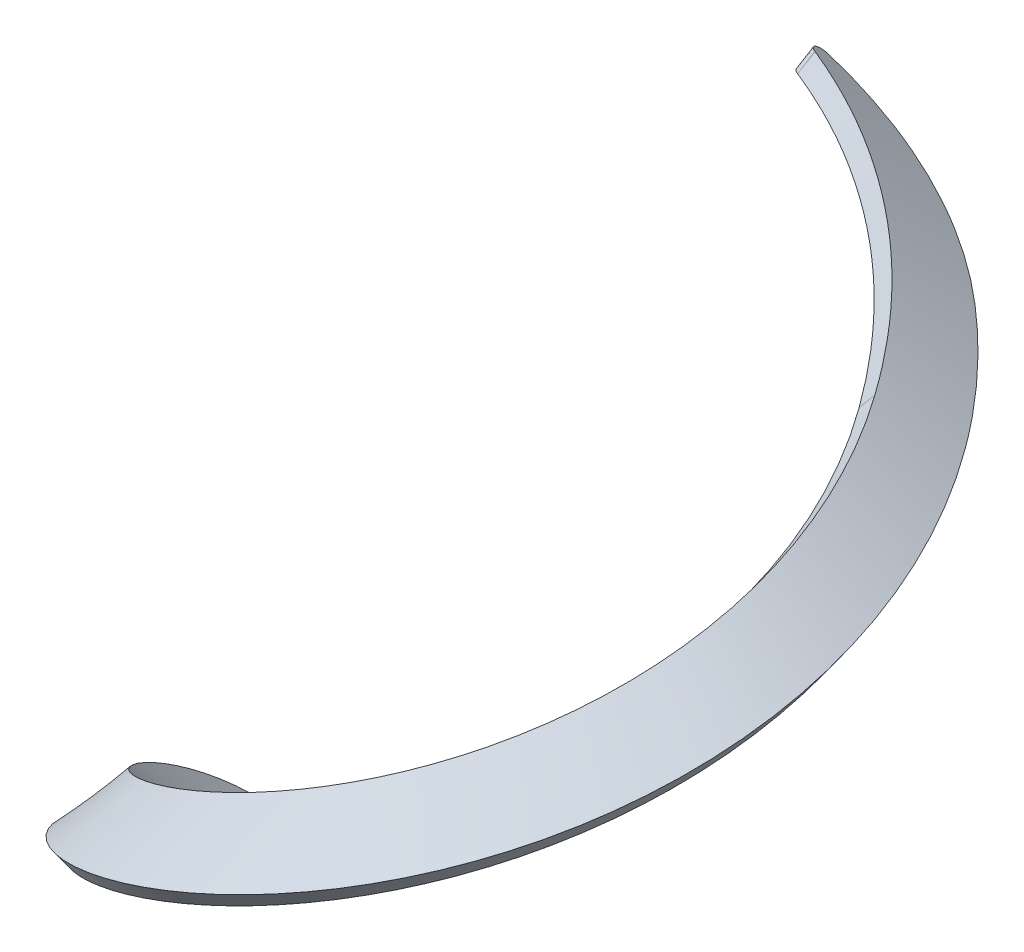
SolidWorks part; units mm, degrees
ref_plane "Vorne" through (0, 0, 0) normal (0, 0, 1) x (1, 0, 0)
ref_plane "Oben" through (0, 0, 0) normal (0, 1, 0) x (1, 0, 0)
ref_plane "Rechts" through (0, 0, 0) normal (1, 0, 0) x (0, 0, -1)
sketch "Skizze1" plane through (0, 0, 0) normal (0, 1, 0) x (1, 0, 0)
  circle A0 centre (0, 0) radius 75
  dimension "D1" = 150
curve "Spirale/Helix1"
sketch "Skizze2" plane through (0, 0, 0) normal (0, 0, 1) x (1, 0, 0)
  line L0 (-75, 0) -> (-38.1382, 25.8109)
  line L1 (0, 0) -> (0, 43.8467) construction
  line L2 (-75, 0) -> (-81.8829, 9.8298)
  dimension "D1" = 35
  dimension "D2" = 45
  dimension "D3" = 12
ref_plane "Ebene1" through (-75, 0, 0) normal (-0.4059, 0.5797, 0.7065) x (0.9127, 0.2178, 0.3457)
ref_plane "Ebene2" through (0, 25.8109, 0) normal (0, 1, 0) x (-1, 0, 0)
sketch "Skizze4" plane through (0, 25.8109, 0) normal (0, 1, 0) x (-1, 0, 0)
  circle A0 centre (0, 0) radius 38.1382
curve "Spirale/Helix2"
sketch3d "3D-Skizze1"
  spline S1 degree 3 number of poles 66 (-75, 0, 0) -> (0, 290, -278.0602)
  spline S2 degree 3 number of poles 66 (-75, 0, 0) -> (0, 290, -278.0602)
  dimension "D1" = 0
sketch3d "3D-Skizze2"
  spline S1 degree 3 number of poles 66 (-38.1382, 25.8109, 0) -> (0, 315.8109, -241.1983)
  spline S2 degree 3 number of poles 66 (-38.1382, 25.8109, 0) -> (0, 315.8109, -241.1983)
  dimension "D1" = 0
sheet metal parameters "Blech1" thickness 12 parameters "D1"=2, "Dicke"=12
lofted bend "Ausgeformte Biegungen1" parameters "D1"=0, "D12"=12
other "Freiform-Biegung1" parameters "D1"=1000, "D4"=57.296, "D5"=1
unfold "Entfalten1"
sketch "Skizze5" plane through (109.3476, 309.5529, -216.7513) normal (0.278, 0.7869, -0.551) x (0.9606, -0.2277, 0.1594)
  line L0 (-110.361, 16.4364) -> (-110.361, 61.4364) construction
  line L1 (67.1321, -39.7615) -> (40.7459, -76.2138) construction
  line L2 (40.7459, -76.2138) -> (-150.361, -15.95) construction
  line L3 (-150.361, -15.95) -> (-150.361, 106.4364)
  line L4 (-150.361, 106.4364) -> (28.3624, 106.4364)
  line L5 (28.3624, 106.4364) -> (28.3624, 33.4672)
  line L6 (-105.361, 36.4364) -> (-150.361, 36.4364) construction
  line L7 (-110.361, 61.4364) -> (-110.361, 106.4364) construction
  line L8 (-110.361, 16.4364) -> (-110.361, -28.5636) construction
  arc A0 (-106.7805, 41.2307) -> (-106.1271, 31.4954) centre (-105.361, 36.4364) ccw construction
  arc A1 (-106.7805, 41.2307) -> (28.3624, 33.4672) centre (-50.0026, -150.5407) cw
  arc A2 (-106.1271, 31.4954) -> (67.1321, -39.7615) centre (-167.4117, -363.7819) cw construction
  arc A3 (-106.7805, 41.2307) -> (-150.361, -15.95) centre (-89.4991, -17.1383) ccw
  spline S0 degree 3 number of poles 94 (-110.361, 61.4364) -> (-45.7331, -483.7139) construction
  spline S2 degree 3 number of poles 84 (-36.7212, -439.6255) -> (-110.361, 16.4364) construction
  dimension "D1" = 20
  dimension "D2" = 5
  dimension "D3" = 200
  dimension "D4" = 400
extrude "Schnitt-Linear austragen1" cut sketch "Skizze5" against normal up to next
sketch "Skizze6" plane through (109.3476, 309.5529, -216.7513) normal (0.278, 0.7869, -0.551) x (0.9606, -0.2277, 0.1594)
  line L0 (67.1321, -39.7615) -> (40.7459, -76.2138) construction
  line L1 (67.1321, -39.7615) -> (40.7459, -76.2138)
  line L2 (40.7459, -76.2138) -> (-150.361, -15.95) construction
  line L3 (40.7459, -76.2138) -> (-150.361, -15.95)
  line L4 (-106.1271, 31.4954) -> (-150.361, -15.95) construction
  line L6 (-150.361, 36.4364) -> (-150.361, -15.95)
  arc A0 (67.1321, -39.7615) -> (-106.1271, 31.4954) centre (-167.4117, -363.7819) ccw construction
  arc A1 (67.1321, -39.7615) -> (-106.1271, 31.4954) centre (-167.4117, -363.7819) ccw
  arc A3 (-106.1271, 31.4954) -> (-150.361, 36.4364) centre (-186.2319, -485.1697) ccw
extrude "Schnitt-Linear austragen2" cut sketch "Skizze6" against normal through all
fold "Falten12"
fillet "Verrundung1" radius 5 6 edges
flat pattern "Abwicklung1"
sketch "Biegung-Linien1" plane through (-8.928, 12.7504, -20.6716) normal (0.345, -0.4927, 0.7989) x (0.9386, 0.1811, -0.2937)
other "Abwickeln-<Freiform-Biegung1>1"
